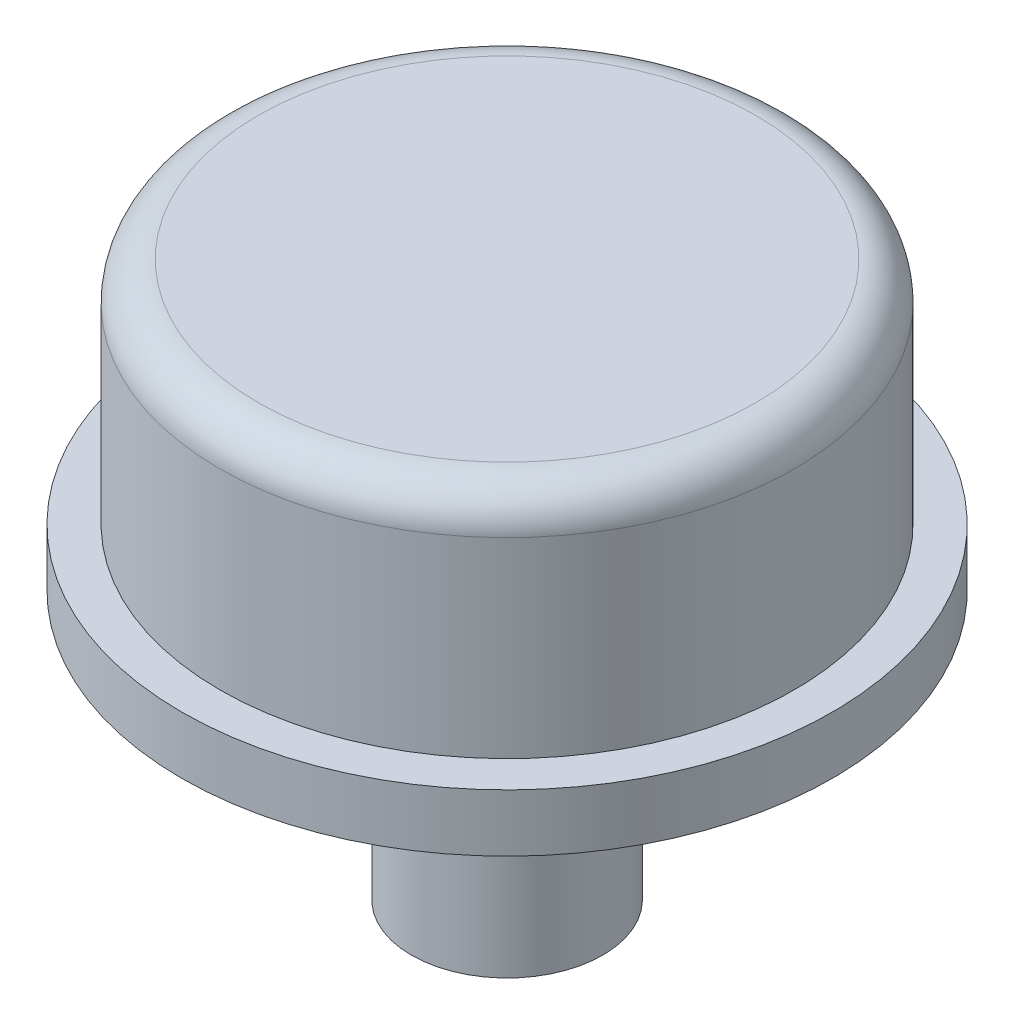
SolidWorks part; units mm, degrees
ref_plane "Plan de face" through (0, 0, 0) normal (0, 0, 1) x (1, 0, 0)
ref_plane "Plan de dessus" through (0, 0, 0) normal (0, 1, 0) x (1, 0, 0)
ref_plane "Plan de droite" through (0, 0, 0) normal (1, 0, 0) x (0, 0, -1)
sketch "Esquisse1" plane through (0, 0, 0) normal (0, 0, 1) x (1, 0, 0)
  line L0 (0, 63.3818) -> (0, -82.0128) construction
  line L1 (-7.5, 0) -> (-8.5, 0)
  line L2 (-8.5, 0) -> (-8.5, -1.5)
  line L3 (-8.5, -1.5) -> (-2.5, -1.5)
  line L4 (-2.5, -1.5) -> (-2.5, -8.5)
  line L5 (-2.5, -8.5) -> (0, -8.5)
  line L6 (0, 6) -> (0, -8.5)
  line L7 (-7.5, 0) -> (-7.5, 6)
  line L8 (-7.5, 6) -> (0, 6)
  dimension "D1" = 8.5
  dimension "D2" = 1.5
  dimension "D3" = 2.5
  dimension "D4" = 8.5
  dimension "D5" = 7.5
  dimension "D6" = 6
revolve "Révolution5" add sketch "Esquisse1" angle 360 about L0
fillet "Congé2" radius 1 1 edges at (0, 6, 7.5)
